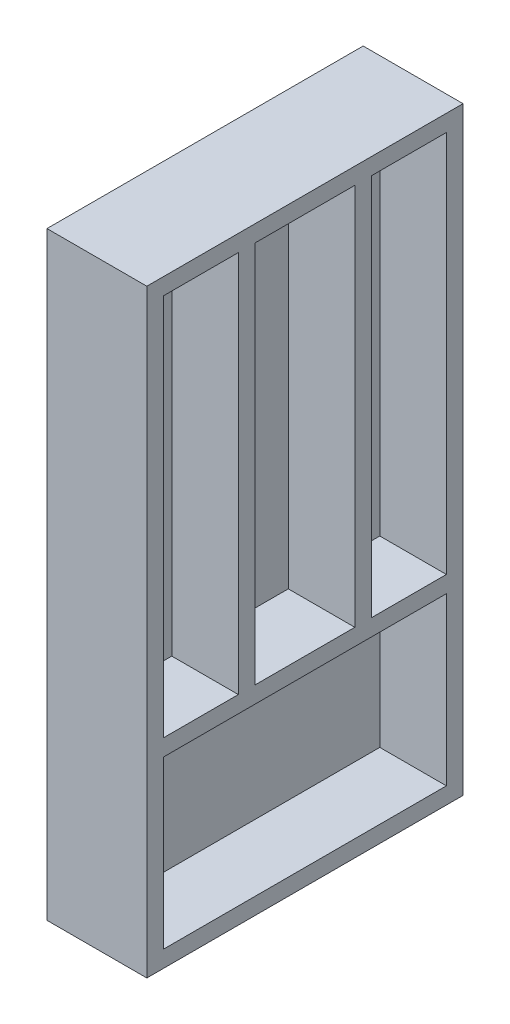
SolidWorks part; units mm, degrees
ref_plane "Front Plane" through (0, 0, 0) normal (1, 0, 0) x (0, 1, 0)
ref_plane "Top Plane" through (0, 0, 0) normal (0, 0, 1) x (0, 1, 0)
ref_plane "Right Plane" through (0, 0, 0) normal (0, 1, 0) x (-1, 0, 0)
sketch "Sketch1" plane through (0, 0, 0) normal (1, 0, 0) x (0, 1, 0)
  line L1 (0, 0) -> (914.4, 0)
  line L2 (0, 0) -> (0, 482.6)
  line L3 (0, 482.6) -> (914.4, 482.6)
  line L4 (914.4, 0) -> (914.4, 482.6)
  dimension "D1" = 914.4
  dimension "D2" = 482.6
extrude "Boss-Extrude1" add sketch "Sketch1" along normal blind 152.4
sketch "Sketch2" plane through (152.4, 0, 0) normal (1, 0, 0) x (0, 1, 0)
  line L10 (914.4, 482.6) -> (0, 482.6) construction
  line L14 (889, 25.4) -> (889, 457.2)
  line L15 (25.4, 25.4) -> (889, 25.4)
  line L16 (25.4, 457.2) -> (25.4, 25.4)
  line L17 (889, 457.2) -> (25.4, 457.2)
  line L18 (889, 25.4) -> (889, 457.2)
  line L19 (25.4, 25.4) -> (889, 25.4)
  line L20 (25.4, 457.2) -> (25.4, 25.4)
  line L21 (889, 457.2) -> (25.4, 457.2)
  dimension "D1" = 25.4
extrude "Cut-Extrude1" cut sketch "Sketch2" against normal blind 101.6
sketch "Sketch3" plane through (50.8, 0, 0) normal (1, 0, 0) x (0, 1, 0)
  line L0 (25.4, 25.4) -> (889, 25.4) construction
  line L1 (279.4, 25.4) -> (304.8, 25.4)
  line L2 (279.4, 25.4) -> (279.4, 457.2)
  line L3 (279.4, 457.2) -> (304.8, 457.2)
  line L4 (304.8, 25.4) -> (304.8, 457.2)
  line L5 (889, 457.2) -> (25.4, 457.2) construction
  line L6 (889, 25.4) -> (889, 457.2) construction
  line L11 (304.8, 317.5) -> (889, 317.5)
  line L12 (304.8, 317.5) -> (304.8, 342.9)
  line L13 (304.8, 342.9) -> (889, 342.9)
  line L14 (889, 317.5) -> (889, 342.9)
  line L16 (304.8, 139.7) -> (889, 139.7)
  line L17 (304.8, 139.7) -> (304.8, 165.1)
  line L18 (304.8, 165.1) -> (889, 165.1)
  line L19 (889, 139.7) -> (889, 165.1)
  dimension "D1" = 254
  dimension "D2" = 25.4
  dimension "D3" = 152.4
  dimension "D4" = 25.4
  dimension "D5" = 25.4
  dimension "D6" = 114.3
extrude "Boss-Extrude2" add sketch "Sketch3" along normal blind 101.6 contours L12 L11 L14 L13 | L2 L1 L4 L3 | L17 L16 L19 L18
